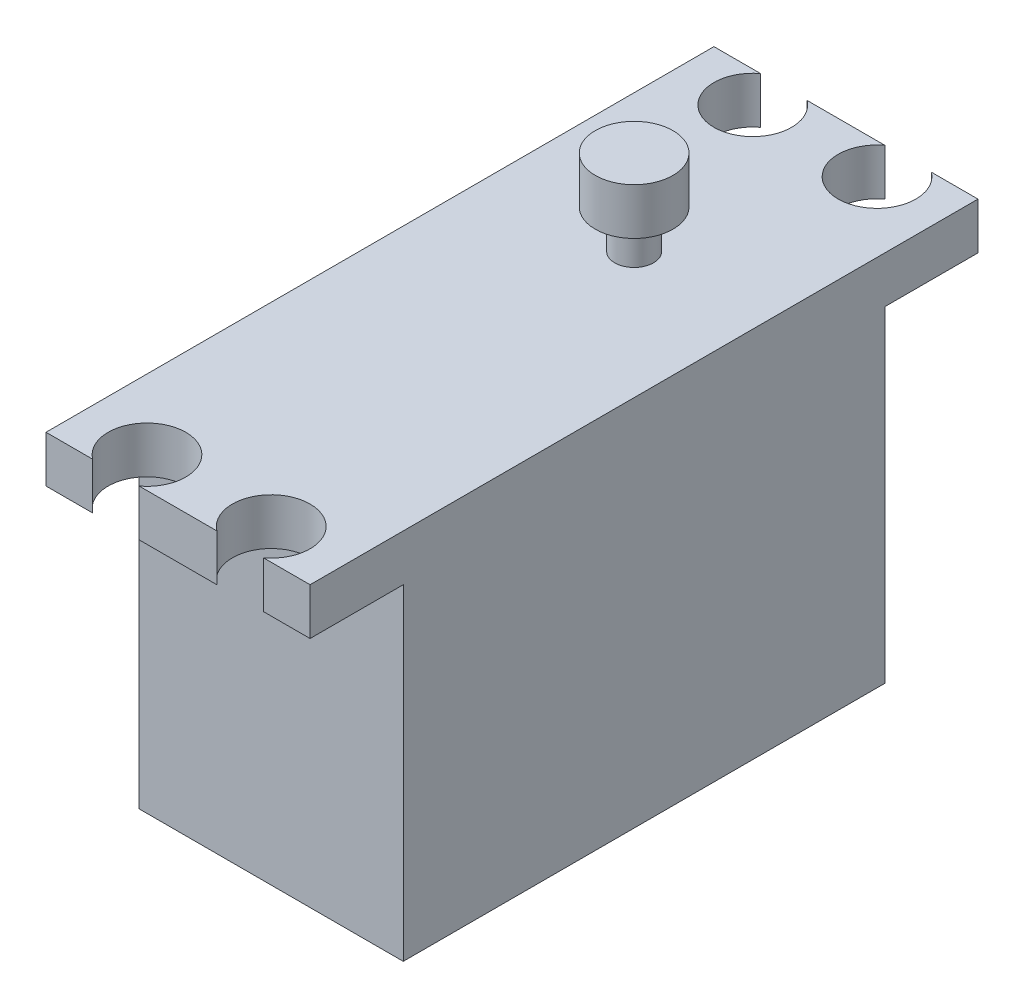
SolidWorks part; units mm, degrees
ref_plane "Front Plane" through (0, 0, 0) normal (0, 0, 1) x (1, 0, 0)
ref_plane "Top Plane" through (0, 0, 0) normal (0, 1, 0) x (1, 0, 0)
ref_plane "Right Plane" through (0, 0, 0) normal (1, 0, 0) x (0, 0, -1)
sketch "Sketch1" plane through (0, 0, 0) normal (0, 1, 0) x (1, 0, 0)
  line L0 (0, 0) -> (0, -31)
  line L1 (0, -31) -> (17, -31)
  line L2 (17, -31) -> (17, 0)
  line L3 (17, 0) -> (0, 0)
  dimension "D1" = 31
  dimension "D2" = 17
extrude "Boss-Extrude1" add sketch "Sketch1" along normal blind 21 contours L0 L1 L2 L3
sketch "Sketch2" plane through (0, 21, 0) normal (0, 1, 0) x (1, 0, 0)
  line L0 (0, 6) -> (0, -37)
  line L1 (0, -37) -> (17, -37)
  line L2 (17, -37) -> (17, 6)
  line L3 (17, 6) -> (0, 6)
  dimension "D1" = 6
  dimension "D2" = 6
  dimension "D3" = 17
extrude "Boss-Extrude2" add sketch "Sketch2" along normal blind 3 contours L3 L0 L1 L2
sketch "Sketch3" plane through (0, 21, 0) normal (0, -1, 0) x (1, 0, 0)
  line L0 (17, 0) -> (0, 0) construction
  line L2 (17, 0) -> (17, -6) construction
  line L4 (24.5361, 15.5) -> (-5.8643, 15.5) construction
  line L5 (17, -6) -> (0, -6) construction
  circle A0 centre (4.5, -4) radius 2.5
  circle A1 centre (12.5, -4) radius 2.5
  circle A2 centre (12.5, 35) radius 2.5
  circle A3 centre (4.5, 35) radius 2.5
  dimension "D2" = 5
  dimension "D3" = 5
  dimension "D1" = 4
  dimension "D4" = 8
  dimension "D5" = 4.5
  dimension "D6" = 21.5
extrude "Cut-Extrude1" cut sketch "Sketch3" against normal blind 3
sketch "Sketch4" plane through (0, 24, 0) normal (0, 1, 0) x (1, 0, 0)
  line L0 (11, 6) -> (6, 6) construction
  circle A0 centre (8.8622, -8) radius 1.25
  dimension "D1" = 14
  dimension "D2" = 2.5
extrude "Boss-Extrude3" add sketch "Sketch4" along normal blind 5.5 contours A0
sketch "Sketch5" plane through (0, 29.5, 0) normal (0, 1, 0) x (1, 0, 0)
  circle A0 centre (8.8622, -8) radius 2.5
  dimension "D1" = 5
extrude "Boss-Extrude4" add sketch "Sketch5" against normal blind 3
